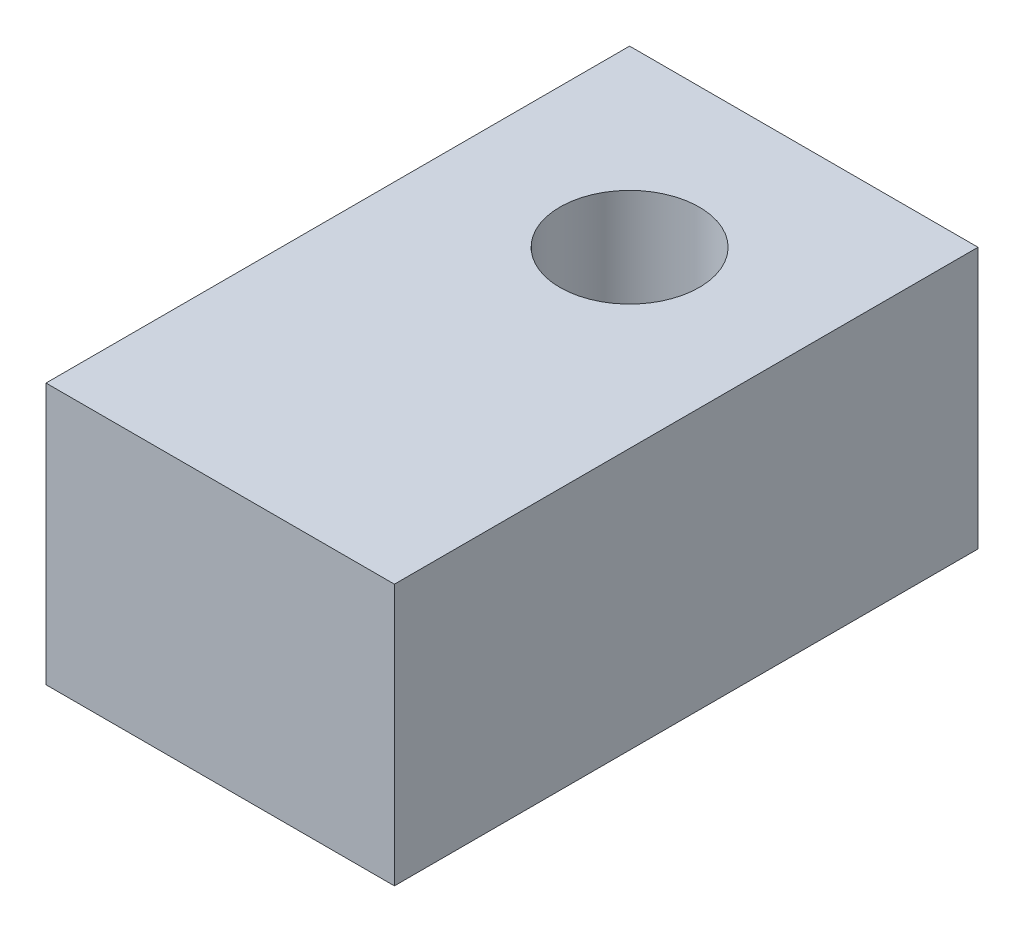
SolidWorks part; units mm, degrees
ref_plane "Alzado" through (0, 0, 0) normal (0, 0, 1) x (1, 0, 0)
ref_plane "Planta" through (0, 0, 0) normal (0, 1, 0) x (1, 0, 0)
ref_plane "Vista lateral" through (0, 0, 0) normal (1, 0, 0) x (0, 0, -1)
sketch "Croquis1" plane through (0, 0, 0) normal (0, 0, 1) x (1, 0, 0)
  line L1 (-20, 15) -> (20, 15)
  line L2 (-20, 15) -> (-20, -15)
  line L3 (-20, -15) -> (20, -15)
  line L4 (20, 15) -> (20, -15)
extrude "Extruir1" add sketch "Croquis1" along normal blind 67
sketch "Croquis2" plane through (0, 15, 0) normal (0, 1, 0) x (1, 0, 0)
  point P0 (0, -20)
hole_wizard "Taladro de diámetro de Ø16.0 (16)1" positions "Croquis3D1" profile "Croquis3" hole size "Ø16.0" standard "ISO"
sketch3d "Croquis3D1"
  point P0 (0, 15, 20)
sketch "Croquis3" plane through (0, 15, 20) normal (1, 0, 0) x (0, 0, 1)
  line L0 (0, 0) -> (0, 30)
  line L1 (0, 30) -> (8, 30)
  line L2 (8, 30) -> (8, 0)
  line L5 (8, 0) -> (0, 0)
  line L11 (0, -6.35) -> (0, 107.95) construction
  dimension "Diámetro de taladro hasta el siguiente" = 16
  dimension "Profundidad de taladro hasta el siguiente" = 30
